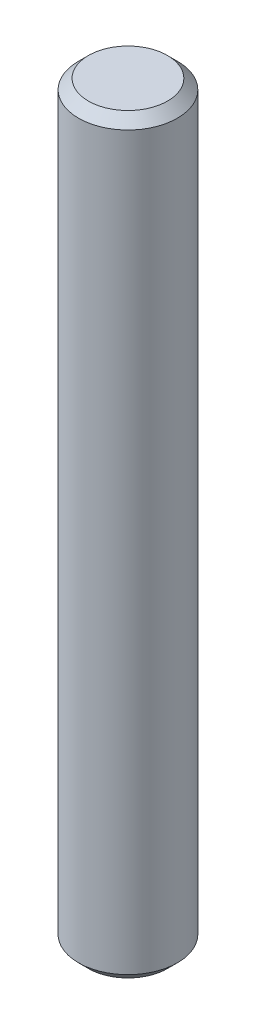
SolidWorks part; units mm, degrees
ref_plane "Front" through (0, 0, 0) normal (0, 0, 1) x (1, 0, 0)
ref_plane "Top" through (0, 0, 0) normal (0, 1, 0) x (1, 0, 0)
ref_plane "Right" through (0, 0, 0) normal (1, 0, 0) x (0, 0, -1)
sketch "Sketch1" plane through (0, 0, 0) normal (0, 1, 0) x (1, 0, 0)
  circle A0 centre (0, 0) radius 2.5
extrude "Extrude1" add sketch "Sketch1" along normal blind 38
chamfer "Chamfer2" distance 0.5 angle 45 1 edges at (0, 38, 2.5)
chamfer "Chamfer3" distance 0.5 angle 45 1 edges at (0, 0, 2.5)
